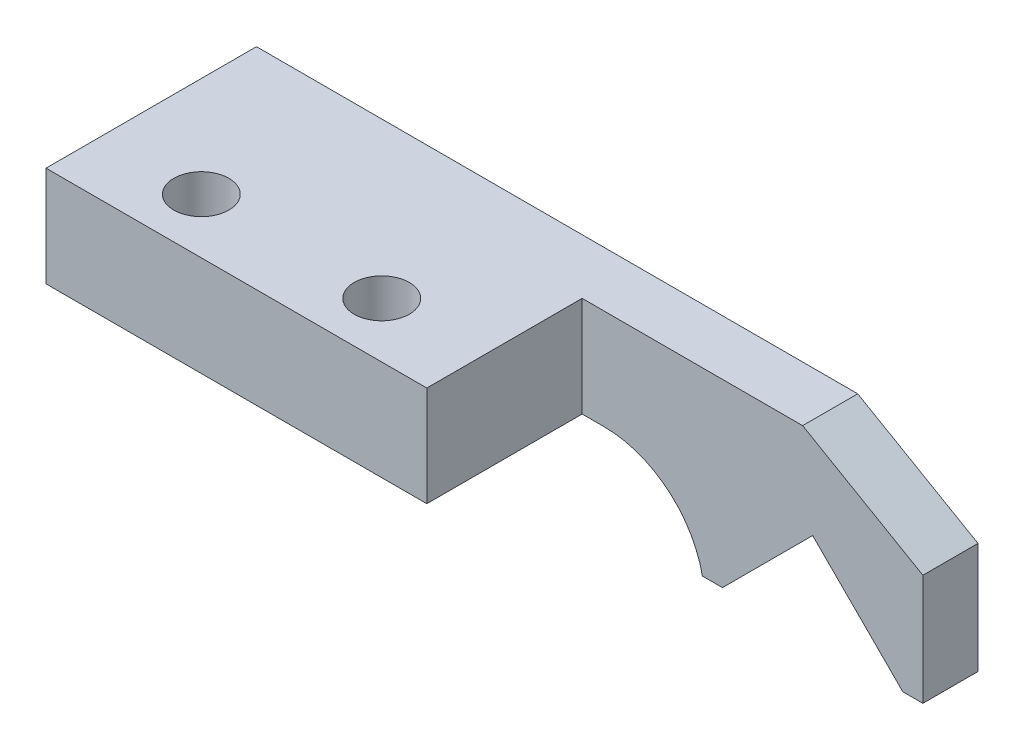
SolidWorks part; units mm, degrees
ref_plane "Plane1" through (0, 0, 0) normal (0, 0, 1) x (1, 0, 0)
ref_plane "Plane2" through (0, 0, 0) normal (0, 1, 0) x (1, 0, 0)
ref_plane "Plane3" through (0, 0, 0) normal (1, 0, 0) x (0, 0, -1)
sketch "Esquisse1" plane through (0, 0, 0) normal (0, 0, 1) x (1, 0, 0)
  line L0 (0, 0) -> (0, 10)
  line L1 (0, 10) -> (60, 10)
  line L2 (60, 10) -> (72, 3.0718)
  line L3 (72, 3.0718) -> (72, -8)
  line L4 (72, -8) -> (70, -8)
  line L5 (70, -8) -> (61, 1)
  line L6 (52, -8) -> (50, -8)
  line L8 (40.202, 0) -> (0, 0)
  line L9 (52, -8) -> (61, 1)
  arc A0 (50, -8) -> (40.202, 0) centre (40.202, -10) ccw
  dimension "D6" = 10
  dimension "D1" = 10
  dimension "D2" = 72
  dimension "D3" = 50
  dimension "D4" = 8
  dimension "D5" = 2
  dimension "D7" = 2
  dimension "D8" = 45
  dimension "D9" = 90
  dimension "D10" = 210
  dimension "D11" = 12
extrude "Base-Extrusion" add sketch "Esquisse1" along normal blind 21
sketch "Esquisse2" plane through (0, 10, 0) normal (0, 1, 0) x (-1, 0, 0)
  line L0 (-38, 5.5) -> (-94.0024, 5.5)
  line L1 (-38, 5.5) -> (-38, 26.0393)
  line L2 (-94.0024, 26.0393) -> (-38, 26.0393)
  line L3 (-94.0024, 26.0393) -> (-94.0024, 5.5)
  line L5 (0, 21) -> (0, 0) construction
  line L6 (-40.202, 0) -> (0, 0) construction
  dimension "D1" = 5.5
  dimension "D2" = 38
extrude "Enlèv. mat.-Extru.1" cut sketch "Esquisse2" against normal through all
sketch "Esquisse3" plane through (0, 0, 0) normal (0, -1, 0) x (1, 0, 0)
  line L0 (38, 21) -> (0, 21) construction
  line L1 (38, 21) -> (38, 5.5) construction
  circle A0 centre (28, 15.5) radius 5
  circle A1 centre (10, 15.5) radius 5
  dimension "D3" = 10
  dimension "D4" = 10
  dimension "D1" = 5.5
  dimension "D2" = 5.5
  dimension "D5" = 10
  dimension "D6" = 18
extrude "Enlèv. mat.-Extru.2" cut sketch "Esquisse3" against normal blind 6
sketch "Esquisse4" plane through (0, 6, 0) normal (0, -1, 0) x (1, 0, 0)
  circle A0 centre (28, 15.5) radius 2.75
  circle A1 centre (10, 15.5) radius 2.75
  dimension "D1" = 5.5
  dimension "D2" = 5.5
extrude "Enlèv. mat.-Extru.3" cut sketch "Esquisse4" against normal blind 6
